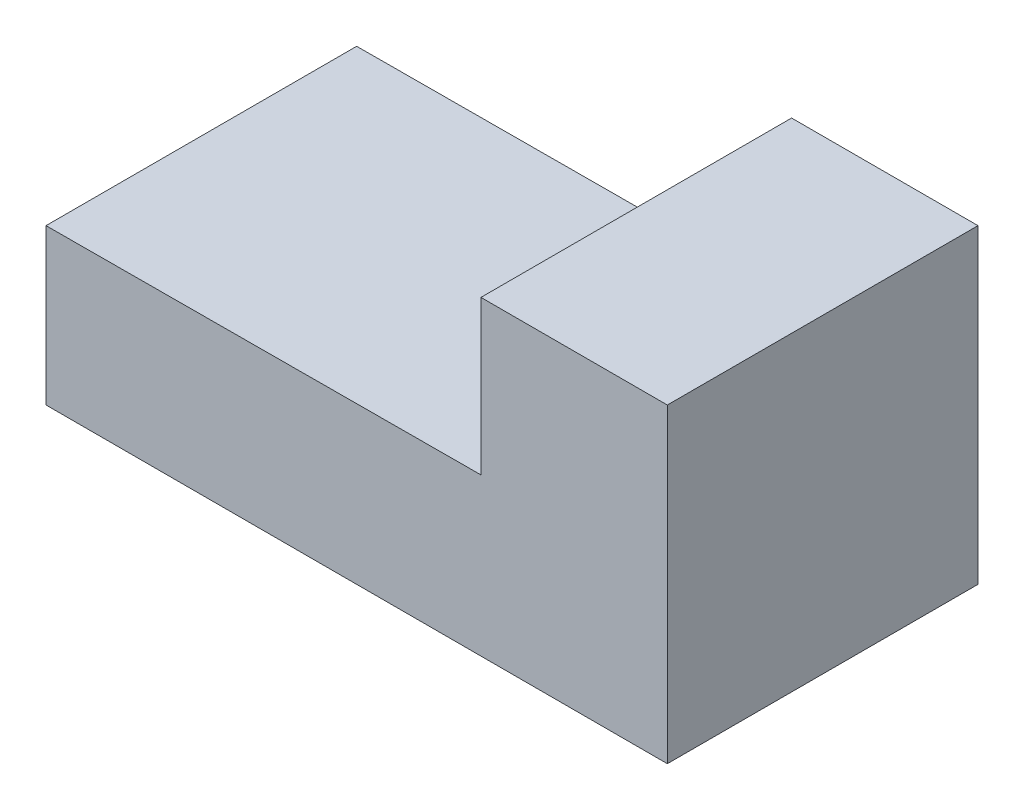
SolidWorks part; units mm, degrees
ref_plane "Plano frontal" through (0, 0, 0) normal (0, 0, 1) x (1, 0, 0)
ref_plane "Plano superior" through (0, 0, 0) normal (0, 1, 0) x (1, 0, 0)
ref_plane "Plano direito" through (0, 0, 0) normal (1, 0, 0) x (0, 0, -1)
sketch "Esboço1" plane through (0, 0, 0) normal (0, 0, 1) x (1, 0, 0)
  line L0 (0, 0) -> (0, -15)
  line L1 (0, -15) -> (60, -15)
  line L2 (60, -15) -> (60, 15)
  line L3 (60, 15) -> (42, 15)
  line L4 (42, 15) -> (42, 0.1563)
  line L5 (42, 0.1563) -> (0, 0)
  dimension "D1" = 15
  dimension "D2" = 60
  dimension "D3" = 30
  dimension "D4" = 18
extrude "Ressalto-extrusão1" add sketch "Esboço1" along normal blind 30
